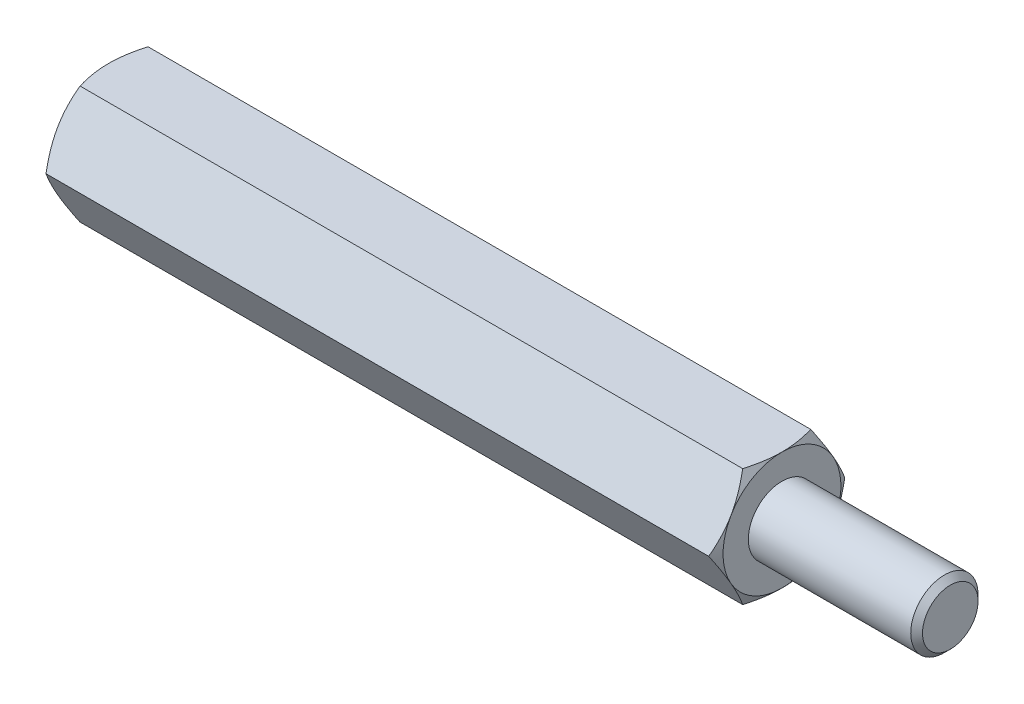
SolidWorks part; units mm, degrees
ref_plane "Front Plane" through (0, 0, 0) normal (0, 0, 1) x (1, 0, 0)
ref_plane "Top Plane" through (0, 0, 0) normal (0, 1, 0) x (1, 0, 0)
ref_plane "Right Plane" through (0, 0, 0) normal (1, 0, 0) x (0, 0, -1)
sketch "Sketch1" plane through (0, 0, 0) normal (1, 0, 0) x (0, 0, -1)
  line L1 (2.0207, 3.5) -> (-2.0207, 3.5)
  line L2 (-2.0207, 3.5) -> (-4.0415, 0)
  line L3 (-4.0415, 0) -> (-2.0207, -3.5)
  line L4 (-2.0207, -3.5) -> (2.0207, -3.5)
  line L5 (2.0207, -3.5) -> (4.0415, 0)
  line L6 (4.0415, 0) -> (2.0207, 3.5)
  circle A0 centre (0, 0) radius 3.5 construction
  dimension "D1" = 7
extrude "Extrude2" add sketch "Sketch1" along normal mid plane 40
sketch "Sketch2" plane through (0, 0, 0) normal (0, 0, 1) x (1, 0, 0)
  line L0 (-20, 3.5) -> (-18.5, 6.0981)
  line L1 (-20, 6.5) -> (-20, 3.5)
  line L3 (0, 0) -> (50000, 0) construction
  arc A0 (-18.5, 6.0981) -> (-20, 6.5) centre (-19.1962, 6.5) ccw
  dimension "D1" = 30
  dimension "D2" = 3
revolve "Cut-Revolve1" cut sketch "Sketch2" angle 360 about L3
mirror "Mirror1" about plane through (0, 0, 0) normal (1, 0, 0) of "Cut-Revolve1"
sketch "Sketch3" plane through (-20, 0, 0) normal (-1, 0, 0) x (0, 0, 1)
  circle A0 centre (0, 0) radius 1.65
  dimension "D1" = 3.3
extrude "Extrude3" cut sketch "Sketch3" against normal blind 10
sketch "Sketch4" plane through (0, 0, 0) normal (0, 0, 1) x (1, 0, 0)
  line L0 (-10, 0) -> (-10, 1.65)
  line L1 (19.6874, 0) -> (-19.6874, 0) construction
  line L2 (-10, 1.65) -> (-9.0474, 0)
  line L3 (-9.0474, 0) -> (-10, 0)
  line L4 (-20, 1.75) -> (-20, -1.75) construction
  point P4 (-20, 0)
  dimension "D1" = 30
  dimension "D2" = 1.65
  dimension "D3" = 10
revolve "Cut-Revolve2" cut sketch "Sketch4" angle 360 about L3
sketch "Sketch5" plane through (20, 0, 0) normal (1, 0, 0) x (0, 0, -1)
  circle A0 centre (0, 0) radius 2
  dimension "D1" = 4
extrude "Extrude4" add sketch "Sketch5" along normal blind 10
chamfer "Chamfer1" distance 0.35 angle 45 1 edges at (30, 0, -2)
equation "\"D2@Sketch4\" = \"D1@Sketch3\"/2"
